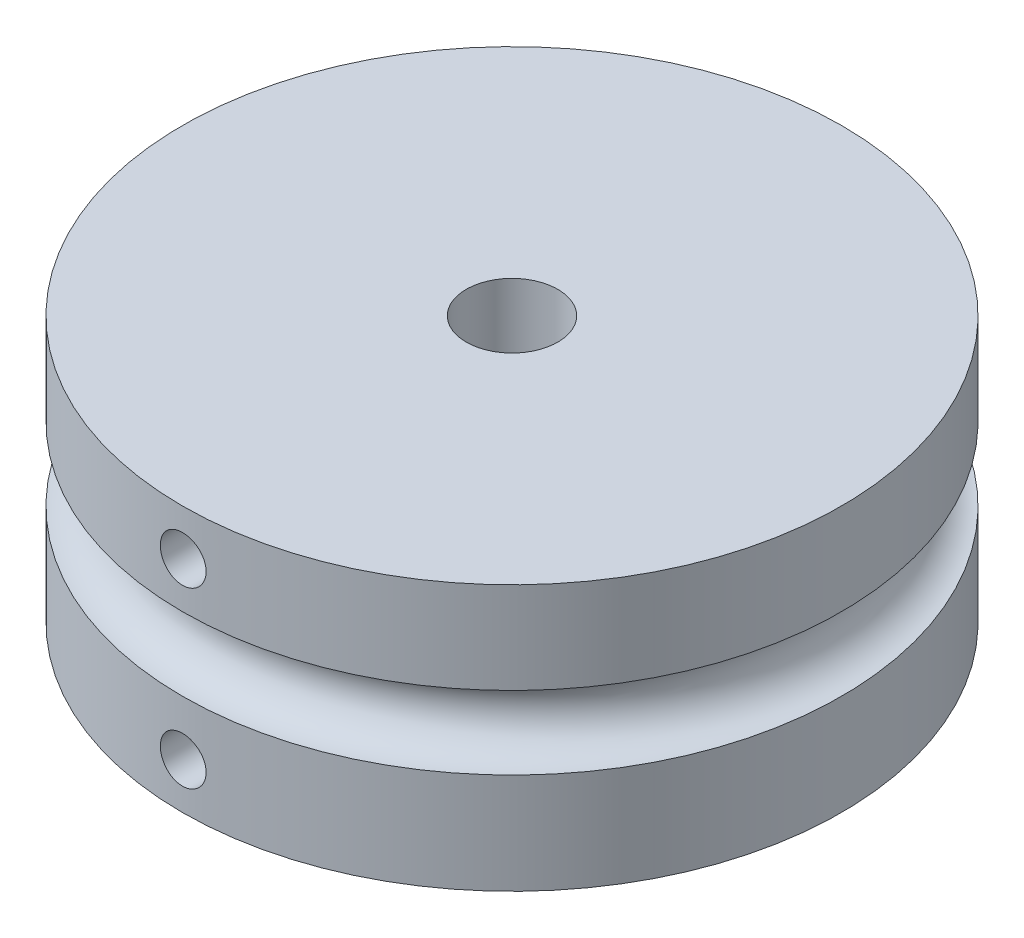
SolidWorks part; units mm, degrees
ref_plane "Front" through (0, 0, 0) normal (0, 0, 1) x (1, 0, 0)
ref_plane "Top" through (0, 0, 0) normal (0, 1, 0) x (1, 0, 0)
ref_plane "Right" through (0, 0, 0) normal (1, 0, 0) x (0, 0, -1)
sketch "Sketch1" plane through (0, 0, 0) normal (0, 1, 0) x (1, 0, 0)
  circle A0 centre (0, 0) radius 18
  dimension "D1" = 36
extrude "Boss-Extrude1" add sketch "Sketch1" along normal mid plane 14.5
sketch "Sketch2" plane through (0, 0, 0) normal (0, 0, 1) x (1, 0, 0)
  line L1 (-18, -7.25) -> (18, -7.25) construction
  line L2 (-18, 7.25) -> (-18, -7.25) construction
  circle A0 centre (-18, 0.25) radius 2
  dimension "D1" = 4
  dimension "D2" = 7.5
revolve "Cut-Revolve1" cut sketch "Sketch2" angle 360 about axis through (0, 7.25, 0) along (0, -1, 0)
hole_wizard "Ø5.0mm Dowel Hole1" positions "Sketch3" profile "Sketch4" hole size "Ø5.0" standard "ANSI Metric"
sketch "Sketch3" plane through (0, 7.25, 0) normal (0, 1, 0) x (1, 0, 0)
  point P0 (0, 0)
sketch "Sketch4" plane through (0, 7.25, 0) normal (1, 0, 0) x (0, 0, 1)
  line L0 (0, 0) -> (0, 14.5)
  line L1 (0, 14.5) -> (2.5, 14.5)
  line L2 (2.5, 14.5) -> (2.5, 0)
  line L5 (2.5, 0) -> (0, 0)
  line L11 (0, -6.35) -> (0, 107.95) construction
  dimension "Thru Hole Dia." = 5
  dimension "Thru Hole Depth" = 14.5
hole_wizard "M3x0.5 Tapped Hole1" positions "3DSketch1" profile "Sketch5" tap size "M3x0.5" standard "ANSI Metric"
sketch3d "3DSketch1"
  line L0 (0, 7.25, 0) -> (0, 2.25, 0) construction
  line L1 (0, 0, 0) -> (0, 4.75, 0) construction
  line L2 (0, 4.75, 0) -> (0, 4.75, 18) construction
  point P0 (0, 14.6251, 0)
  point P5 (0, 4.75, 18)
  dimension "D1" = 4.75
sketch "Sketch5" plane through (0, 4.75, 18) normal (1, 0, 0) x (0, -1, 0)
  line L0 (0, 0) -> (0, 18.7511)
  line L1 (0, 18.7511) -> (1.25, 18)
  line L2 (1.25, 18) -> (1.25, 0)
  line L5 (1.25, 0) -> (0, 0)
  line L10 (0, 18.7511) -> (-1.25, 18) construction
  line L11 (0, -6.35) -> (0, 107.95) construction
  dimension "Tap Drill Dia." = 2.5
  dimension "Tap Drill Depth" = 18
  dimension "Drill Angle" = 118
mirror "Mirror1" about plane through (0, 0, 0) normal (0, 1, 0) of "M3x0.5 Tapped Hole1"
